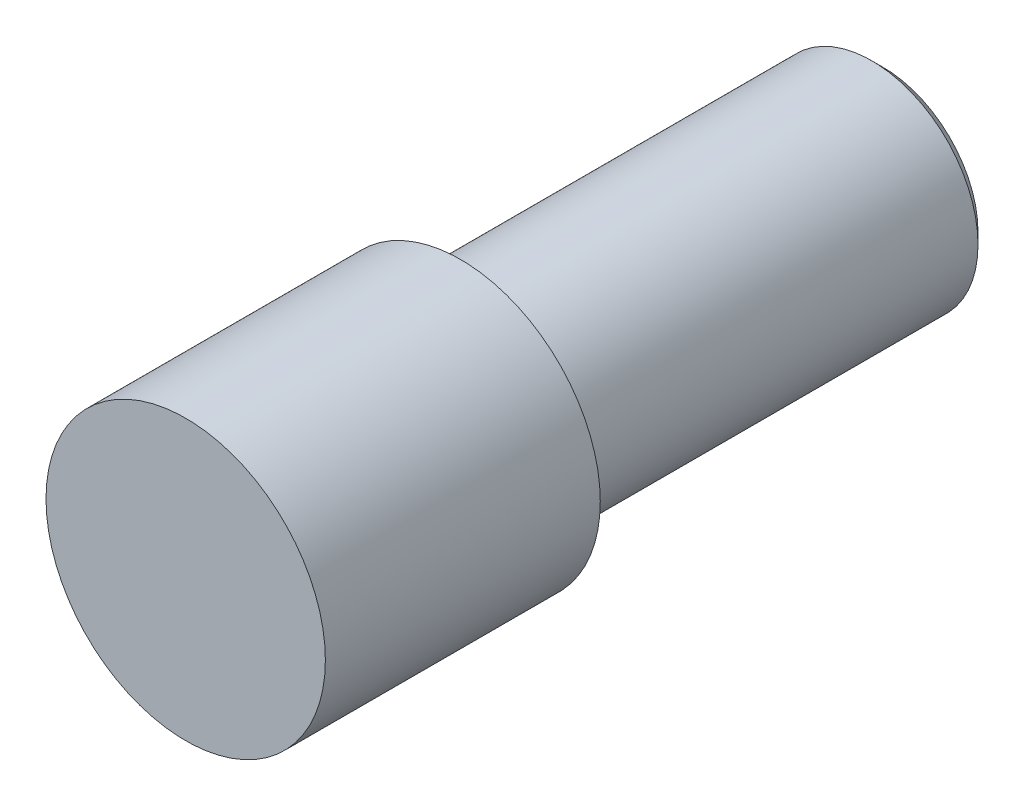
SolidWorks part; units mm, degrees
ref_plane "Спереди" through (0, 0, 0) normal (0, 0, 1) x (1, 0, 0)
ref_plane "Сверху" through (0, 0, 0) normal (0, 1, 0) x (1, 0, 0)
ref_plane "Справа" through (0, 0, 0) normal (1, 0, 0) x (0, 0, -1)
sketch "Эскиз1" plane through (0, 0, 0) normal (1, 0, 0) x (0, 0, -1)
  line L0 (0, 0) -> (39.361, 0) construction
  line L1 (0, 0) -> (0, 1.5875)
  line L2 (0, 1.5875) -> (3.1242, 1.5875)
  line L3 (3.1242, 1.5875) -> (3.1242, 1.2065)
  line L4 (3.1242, 1.2065) -> (7.7978, 1.2065)
  line L5 (7.9248, 1.0795) -> (7.9248, 0)
  line L6 (7.9248, 0) -> (0, 0)
  line L7 (7.7978, 1.2065) -> (7.9248, 1.0795)
  point P3 (7.9248, 1.2065)
  dimension "D1" = 7.9248
  dimension "D2" = 3.1242
  dimension "D3" = 3.175
  dimension "D4" = 2.413
revolve "Повернуть1" add sketch "Эскиз1" angle 360 about L0
